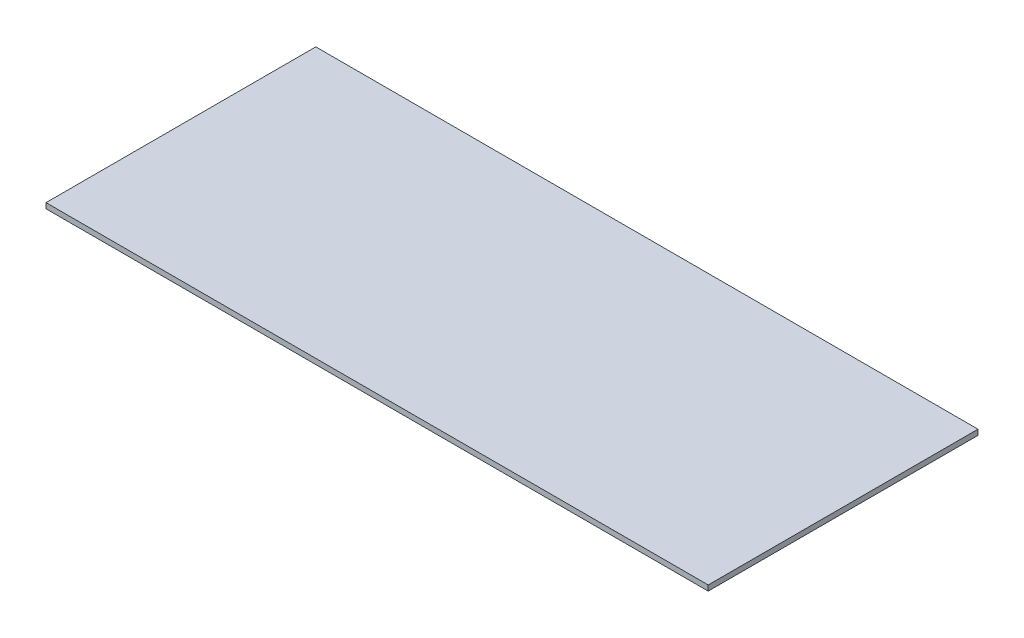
SolidWorks part; units mm, degrees
ref_plane "Front Plane" through (0, 0, 0) normal (0, 0, 1) x (1, 0, 0)
ref_plane "Top Plane" through (0, 0, 0) normal (0, 1, 0) x (1, 0, 0)
ref_plane "Right Plane" through (0, 0, 0) normal (1, 0, 0) x (0, 0, -1)
sketch "Sketch1" plane through (0, 0, 0) normal (0, 1, 0) x (1, 0, 0)
  line L1 (-342.9, -139.7) -> (342.9, -139.7)
  line L2 (-342.9, -139.7) -> (-342.9, 139.7)
  line L3 (-342.9, 139.7) -> (342.9, 139.7)
  line L4 (342.9, -139.7) -> (342.9, 139.7)
  line L5 (-342.9, -139.7) -> (342.9, 139.7) construction
  line L6 (-342.9, 139.7) -> (342.9, -139.7) construction
  point P0 (0, 0)
  dimension "D1" = 279.4
  dimension "D2" = 685.8
extrude "Boss-Extrude1" add sketch "Sketch1" along normal blind 5.5562
